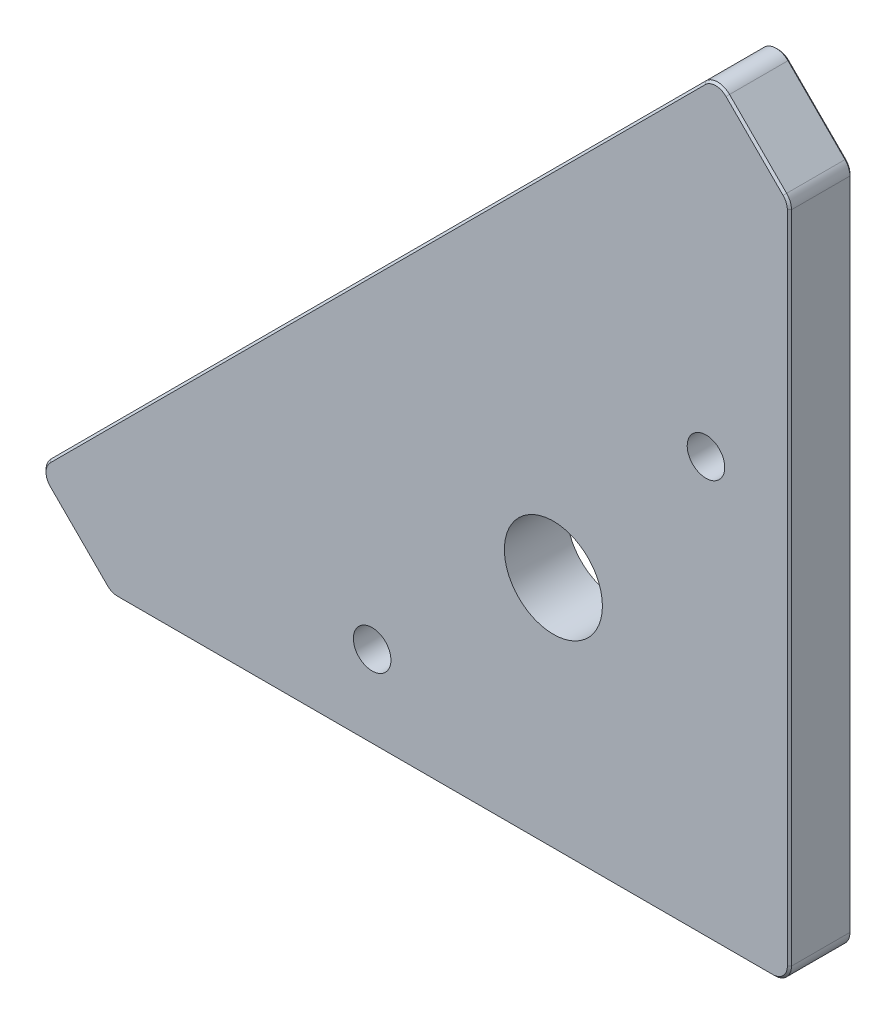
SolidWorks part; units mm, degrees
ref_plane "Ebene vorne" through (0, 0, 0) normal (0, 0, 1) x (1, 0, 0)
ref_plane "Ebene oben" through (0, 0, 0) normal (0, 1, 0) x (1, 0, 0)
ref_plane "Ebene rechts" through (0, 0, 0) normal (1, 0, 0) x (0, 0, -1)
sketch "Skizze1" plane through (0, 0, 0) normal (0, 0, 1) x (1, 0, 0)
  line L0 (0, 0) -> (-197.9899, 0)
  line L1 (-197.9899, 0) -> (0, 197.9899)
  line L2 (0, 197.9899) -> (0, 0)
  dimension "D1" = 280
extrude "Aufsatz-Linear austragen1" add sketch "Skizze1" along normal blind 15
sketch "Skizze4" plane through (0, 0, 0) normal (0, 0, -1) x (-1, 0, 0)
  line L0 (0, 162.6346) -> (17.6777, 180.3122)
  line L1 (0, 0) -> (0, 197.9899) construction
  line L2 (0, 197.9899) -> (197.9899, 0) construction
  line L3 (17.6777, 180.3122) -> (0, 197.9899)
  line L4 (0, 197.9899) -> (0, 162.6346)
  line L5 (162.6346, 0) -> (180.3122, 17.6777)
  line L6 (197.9899, 0) -> (0, 0) construction
  line L7 (180.3122, 17.6777) -> (197.9899, 0)
  line L8 (197.9899, 0) -> (162.6346, 0)
  dimension "D1" = 25
extrude "Schnitt-Linear austragen2" cut sketch "Skizze4" against normal through all
fillet "Verrundung1" radius 4 5 edges at (0, 0, 7.5) (0, 162.6346, 7.5) (-17.6777, 180.3122, 7.5) (-180.3122, 17.6777, 7.5) (-162.6346, 0, 7.5)
hole_wizard "M25x1.5 Gewindebohrung1" positions "Skizze5" profile "Skizze6" tap size "M25x1.5" standard "DIN"
sketch "Skizze5" plane through (0, 0, 15) normal (0, 0, 1) x (1, 0, 0)
  line L0 (-98.9949, 98.9949) -> (-1.1716, 1.1716) construction
  line L1 (-20.5061, 177.4838) -> (-177.4838, 20.5061) construction
  arc A0 (-4, 0) -> (0, 4) centre (-4, 4) ccw construction
  point P0 (-56.5685, 56.5685)
  dimension "D1" = 60
sketch "Skizze6" plane through (-56.5685, 56.5685, 15) normal (1, 0, 0) x (0, -1, 0)
  line L0 (0, 0) -> (0, 64.5601)
  line L1 (0, 64.5601) -> (11.75, 57.5)
  line L2 (11.75, 57.5) -> (11.75, 0)
  line L5 (11.75, 0) -> (0, 0)
  line L10 (0, 64.5601) -> (-11.75, 57.5) construction
  line L11 (0, -6.35) -> (0, 107.95) construction
  dimension "Bohrerdurchmesser" = 23.5
  dimension "Bohrungstiefe" = 57.5
  dimension "Spitzenwinkel" = 118
hole_wizard "Formsenkung für M8 Senkschraube mit Innensechskant1" positions "Skizze9" profile "Skizze10" countersink size "M8" standard "DIN"
sketch "Skizze9" plane through (0, 0, 0) normal (0, 0, 1) x (1, 0, 0)
  line L0 (-160.9777, 0) -> (-4, 0) construction
  line L1 (0, 4) -> (0, 160.9777) construction
  point P0 (-20, 100)
  point P2 (-100, 20)
sketch "Skizze10" plane through (-20, 100, 0) normal (1, 0, 0) x (0, 1, 0)
  line L0 (0, 0) -> (0, 15)
  line L1 (0, 15) -> (4.5, 15)
  line L2 (4.5, 15) -> (4.5, 4.625)
  line L3 (4.5, 4.625) -> (9.125, 0)
  line L5 (9.125, 0) -> (0, 0)
  line L6 (-4.5, 4.625) -> (-9.125, 0) construction
  line L11 (0, -6.35) -> (0, 107.95) construction
  dimension "Bohrerdurchmesser" = 9
  dimension "Bohrungstiefe" = 15
  dimension "Senkdurchmesser (Oben)" = 18.25
  dimension "Senkwinkel (Oben)" = 90
chamfer "Fase1" distance 0.5 angle 45 20 edges at (-1.1716, 1.1716, 15) (0, 82.4889, 15) (-82.4889, 0, 15) (-0.3045, 162.5084, 15) (-162.5084, 0.3045, 15) (-8.0104, 170.645, 15) (-170.645, 8.0104, 15) (-17.6777, 178.6554, 15) (-178.6554, 17.6777, 15) (-98.9949, 98.9949, 15) (-1.1716, 1.1716, 0) (0, 82.4889, 0) (-82.4889, 0, 0) (-0.3045, 162.5084, 0) (-162.5084, 0.3045, 0) (-8.0104, 170.645, 0) (-170.645, 8.0104, 0) (-17.6777, 178.6554, 0) (-178.6554, 17.6777, 0) (-98.9949, 98.9949, 0)
equation "\"D3@Skizze9\"=\"D2@Skizze9\""
equation "\"D4@Skizze9\"=\"D1@Skizze9\""
